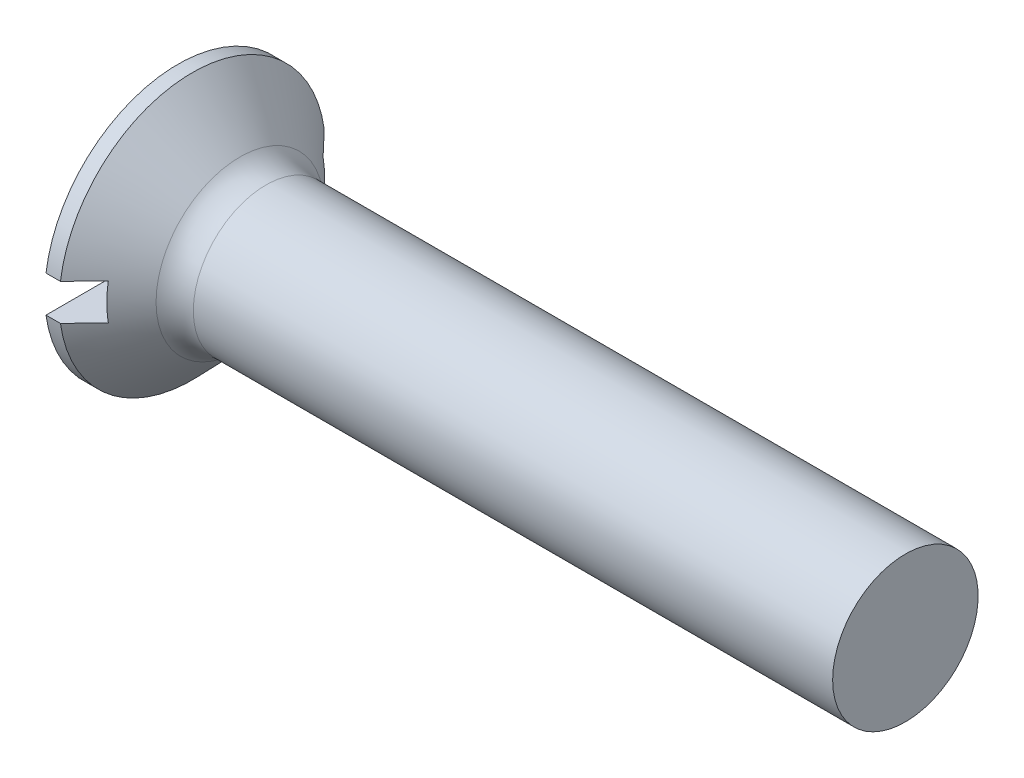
SolidWorks part; units mm, degrees
ref_plane "Front Plane" through (0, 0, 0) normal (0, 0, 1) x (1, 0, 0)
ref_plane "Top Plane" through (0, 0, 0) normal (0, 1, 0) x (1, 0, 0)
ref_plane "Right Plane" through (0, 0, 0) normal (1, 0, 0) x (0, 0, -1)
sketch "BodySke" plane through (0, 0, 0) normal (0, 0, 1) x (1, 0, 0)
  line L0 (0, 0) -> (111.3824, 0) construction
  line L1 (0, 0) -> (0, 9.15)
  line L2 (0, 9.15) -> (0.9924, 9.15)
  line L3 (0.9924, 9.15) -> (5, 5)
  line L4 (5, 5) -> (50, 5)
  line L5 (50, 5) -> (50, 0)
  line L6 (6.5, 8.824) -> (6.5, -5.8939) construction
  line L7 (0, 0) -> (50, 0)
  line L8 (12, 8.824) -> (12, -4.958) construction
  line L9 (0, -9.15) -> (0.9924, -9.15) construction
  line L10 (0.9924, -9.15) -> (5, -5) construction
  line L11 (5, -5) -> (50, -5) construction
  point P10 (50, 4.172)
  dimension "Diameter" = 10
  dimension "Head_dia" = 18.3
  dimension "Head_height" = 5
  dimension "Length" = 50
  dimension "Advance" = 1.5
  dimension "Thread_minor" = 8.344
  dimension "Thread_length" = 38
  dimension "Head_ang" = 92
revolve "BaseBody" add sketch "BodySke" angle 360 about L0
fillet "Fillet1" radius 2.5 1 edges at (5, 0, 5)
sketch "SlotSke" plane through (0, 0, 0) normal (-1, 0, 0) x (0, 0, 1)
  line L1 (-9.15, 1.25) -> (9.15, 1.25)
  line L2 (-9.15, 1.25) -> (-9.15, -1.25)
  line L3 (-9.15, -1.25) -> (9.15, -1.25)
  line L4 (9.15, 1.25) -> (9.15, -1.25)
  dimension "D1" = 18.3
  dimension "D2" = 9.15
  dimension "D3" = 1.25
  dimension "Slot_width" = 2.5
extrude "Slot" cut sketch "SlotSke" against normal blind 2.6
sketch "ThdSchSke" plane through (0, 0, 0) normal (0, 0, 1) x (1, 0, 0)
  line L0 (0, 0) -> (55.1256, 0) construction
  line L1 (0, 0) -> (111.3824, 0) construction
  line L2 (49.522, 5) -> (49.522, 5.9561)
  line L3 (49.522, 5.9561) -> (50.478, 5.9561)
  line L4 (50.478, 5.9561) -> (50.478, 5)
  line L5 (50.478, 5) -> (50, 4.172)
  line L6 (50, 4.172) -> (49.522, 5)
  line L7 (5, 5) -> (50, 5) construction
  line L13 (50, 5) -> (50, 0) construction
revolve "ThreadSchematic" [suppressed] cut sketch "ThdSchSke" angle 360 about L0
pattern_linear "ThdSchPat" [suppressed] count 26 along (1, 0, 0)
equation "\"Thread_minor@ThreadCosmetic\" = \"Thread_minor@BodySke\""
equation "\"Thread_length@ThreadCosmetic\" = \"Thread_length@BodySke\""
equation "\"D1@SlotSke\" = \"Head_dia@BodySke\""
equation "\"D2@SlotSke\" = \"D1@SlotSke\" / 2"
equation "\"D3@SlotSke\" = \"Slot_width@SlotSke\" / 2"
equation "\"Advance@ThdSchPat\" = \"Advance@BodySke\""
equation "\"D1@ThdSchPat\" =  int( \"Thread_length@BodySke\" / \"Advance@ThdSchPat\" )   + 1"
